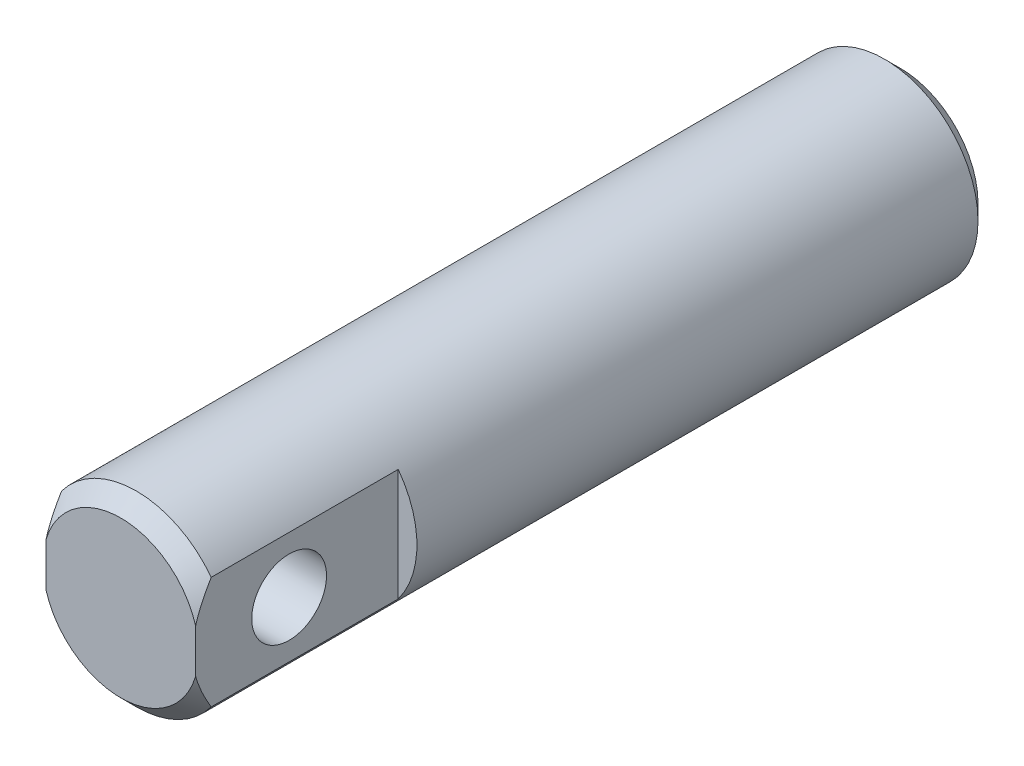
SolidWorks part; units mm, degrees
ref_plane "Plan1" through (0, 0, 0) normal (0, 0, 1) x (1, 0, 0)
ref_plane "Plan2" through (0, 0, 0) normal (0, 1, 0) x (1, 0, 0)
ref_plane "Plan3" through (0, 0, 0) normal (1, 0, 0) x (0, 0, -1)
sketch "Esquisse1" plane through (0, 0, 0) normal (0, 0, 1) x (1, 0, 0)
  circle A0 centre (0, 0) radius 3
extrude "Base-Extrusion" add sketch "Esquisse1" along normal blind 25
chamfer "Chanfrein2" distance 0.5 angle 45
sketch "Esquisse2" plane through (0, 0, 25) normal (0, 0, 1) x (1, 0, 0)
  line L0 (2.4, 3) -> (4.4, 3)
  line L1 (2.4, 3) -> (2.4, -3)
  line L2 (4.4, -3) -> (2.4, -3)
  line L3 (4.4, -3) -> (4.4, 3)
extrude "Enlèv. mat.-Extru.1" cut sketch "Esquisse2" against normal blind 6.5
sketch "Esquisse5" plane through (0, 0, 25) normal (0, 0, 1) x (1, 0, 0)
  line L0 (-4.4, 3) -> (-2.4, 3)
  line L1 (-4.4, 3) -> (-4.4, -3)
  line L2 (-2.4, -3) -> (-4.4, -3)
  line L3 (-2.4, -3) -> (-2.4, 3)
extrude "Enlèv. mat.-Extru.3" cut sketch "Esquisse5" against normal blind 6.5
sketch "Esquisse4" plane through (2.4, 0, 0) normal (1, 0, 0) x (0, 0, -1)
  line L0 (-24.5, 0) -> (-18.5, 0) construction
  circle A0 centre (-22, 0) radius 1.2
  dimension "D1" = 2.4
extrude "Enlèv. mat.-Extru.2" cut sketch "Esquisse4" against normal through all
sketch "Esquisse6" plane through (0, 0, 0) normal (0, 0, -1) x (-1, 0, 0)
  line L0 (-2, 0) -> (-0.9993, 1.7325)
  line L1 (-0.9993, 1.7325) -> (0.9993, 1.7325)
  line L2 (0.9993, 1.7325) -> (2, 0)
  line L3 (2, 0) -> (0.9993, -1.7325)
  line L4 (0.9993, -1.7325) -> (-0.9993, -1.7325)
  line L5 (-0.9993, -1.7325) -> (-2, 0)
extrude "Enlèv. mat.-Extru.4" cut sketch "Esquisse6" against normal blind 3.5
